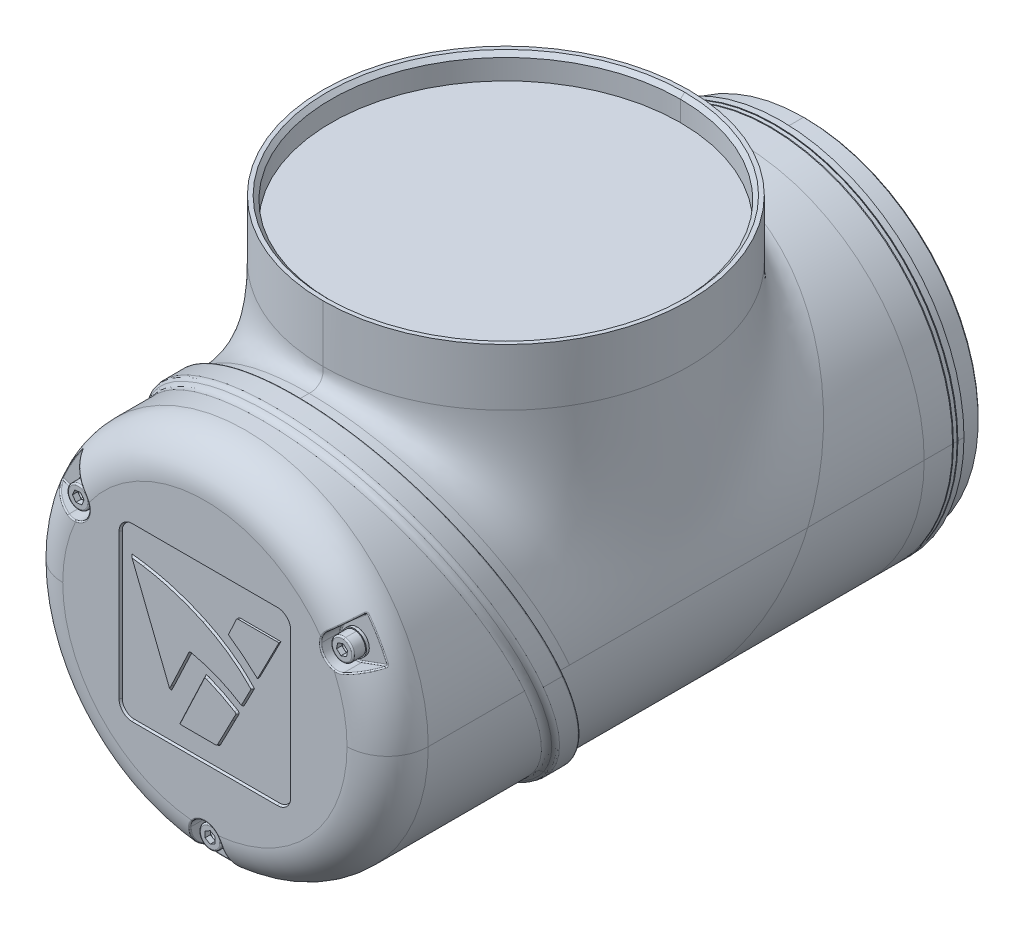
SolidWorks part; units mm, degrees
ref_plane "前视基准面" through (0, 0, 0) normal (0, 0, 1) x (1, 0, 0)
ref_plane "上视基准面" through (0, 0, 0) normal (0, 1, 0) x (1, 0, 0)
ref_plane "右视基准面" through (0, 0, 0) normal (1, 0, 0) x (0, 0, -1)
imported_body "输入1"
chamfer "倒角1" distance 0.5 angle 45
ref_plane "基准面1" through (0, 0, -58) normal (0, 0, -1) x (-1, 0, 0)
ref_plane "基准面2" through (0, 0, -65) normal (0, 0, -1) x (-1, 0, 0)
ref_plane "基准面3" through (0, -11.6142, 27.3614) normal (0, 0.3907, -0.9205) x (-1, 0, 0)
split "分割1" trim tools "基准面2", "基准面1", "基准面3" bodies to split 107 resulting bodies 108 109 110 111
